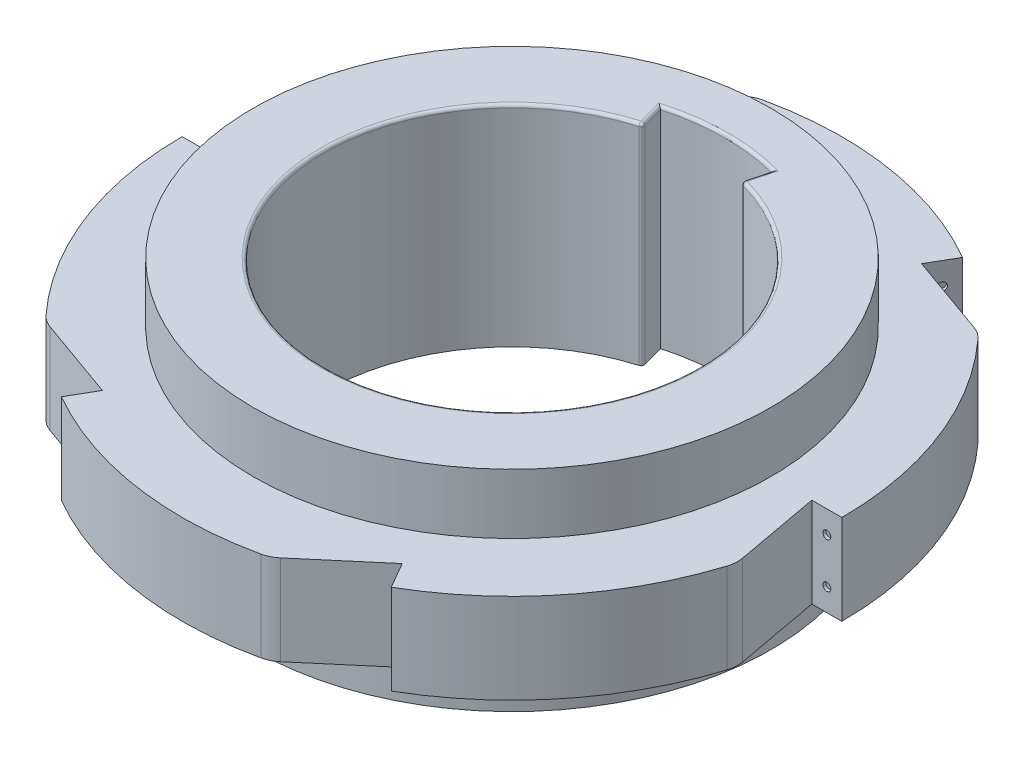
SolidWorks part; units mm, degrees
ref_plane "Front Plane" through (0, 0, 0) normal (0, 0, 1) x (1, 0, 0)
ref_plane "Top Plane" through (0, 0, 0) normal (0, 1, 0) x (1, 0, 0)
ref_plane "Right Plane" through (0, 0, 0) normal (1, 0, 0) x (0, 0, -1)
sketch "Sketch1" plane through (0, 0, 0) normal (0, 1, 0) x (1, 0, 0)
  line L0 (0, 0) -> (100, 0) construction
  line L1 (0, 0) -> (50, -86.6025) construction
  line L2 (50, -86.6025) -> (55, -95.2628)
  line L3 (-50, -86.6025) -> (-55, -95.2628)
  line L4 (100, 0) -> (100, -81.1687) construction
  line L5 (100, 0) -> (105.1902, -28.3244)
  line L6 (100, 0) -> (117.0141, 0) construction
  line L7 (-100, 0) -> (-110, 0)
  line L8 (-50, 86.6025) -> (-55, 95.2628)
  line L9 (50, 86.6025) -> (55, 95.2628)
  line L10 (100, 0) -> (110, 0)
  line L11 (50, -86.6025) -> (28.0654, -105.2596)
  line L12 (-50, -86.6025) -> (-77.1248, -76.9352)
  line L13 (-100, 0) -> (-105.1902, 28.3244)
  line L14 (-50, 86.6025) -> (-28.0654, 105.2596)
  line L15 (50, 86.6025) -> (77.1248, 76.9352)
  arc A2 (23.745, -107.4066) -> (-55, -95.2628) centre (0, 0) cw
  arc A4 (104.8893, -33.1395) -> (55, -95.2628) centre (0, 0) cw
  arc A5 (105.1902, -28.3244) -> (104.8893, -33.1395) centre (95.3539, -30.1268) cw
  arc A6 (-81.1443, -74.2671) -> (-110, 0) centre (0, 0) cw
  arc A7 (-104.8893, 33.1395) -> (-55, 95.2628) centre (0, 0) cw
  arc A8 (-23.745, 107.4066) -> (55, 95.2628) centre (0, 0) cw
  arc A9 (81.1443, 74.2671) -> (110, 0) centre (0, 0) cw
  arc A15 (28.0654, -105.2596) -> (23.745, -107.4066) centre (21.5864, -97.6423) cw
  arc A16 (-77.1248, -76.9352) -> (-81.1443, -74.2671) centre (-73.7676, -67.5155) cw
  arc A17 (-105.1902, 28.3244) -> (-104.8893, 33.1395) centre (-95.3539, 30.1268) cw
  arc A18 (-28.0654, 105.2596) -> (-23.745, 107.4066) centre (-21.5864, 97.6423) cw
  arc A19 (77.1248, 76.9352) -> (81.1443, 74.2671) centre (73.7676, 67.5155) cw
  arc A20 (23.745, -107.4066) -> (-55, -95.2628) centre (0, 0) cw
  arc A21 (-81.1443, -74.2671) -> (-110, 0) centre (0, 0) cw
  arc A22 (-104.8893, 33.1395) -> (-55, 95.2628) centre (0, 0) cw
  arc A23 (-23.745, 107.4066) -> (55, 95.2628) centre (0, 0) cw
  arc A24 (81.1443, 74.2671) -> (110, 0) centre (0, 0) cw
  point P23 (0, 0)
  point P38 (0, 0)
  point P54 (0, 0)
  dimension "D1" = 10
  dimension "D3" = 6
  dimension "D2" = 6
  dimension "D4" = 6
extrude "Boss-Extrude2" add sketch "Sketch1" along normal blind 30
sketch "Sketch2" plane through (0, 30, 0) normal (0, 1, 0) x (1, 0, 0)
  line L2 (-19.1078, 68.7881) -> (-16.7682, 60.3656)
  line L3 (18.0656, 68.7881) -> (15.9142, 60.5964)
  arc A1 (18.0656, 68.7881) -> (-19.035, 68.5261) centre (0, 0) ccw
  arc A2 (-16.7682, 60.3656) -> (15.9142, 60.5964) centre (0, 0) ccw
extrude "Cut-Extrude1" cut sketch "Sketch2" against normal blind 30 contours L2 A2 L3 A1
sketch "Sketch3" plane through (0, 0, 0) normal (0.866, 0, -0.5) x (-0.5, 0, -0.866)
  line L0 (100, 0) -> (110, 0) construction
  line L1 (110, 15) -> (100, 15) construction
  line L2 (110, 30) -> (110, 0) construction
  line L3 (100, 30) -> (100, 0) construction
  circle A1 centre (105, 7.5) radius 1.3214
  circle A2 centre (105, 22.5) radius 1.3214
  dimension "D1" = 7.5
extrude "Cut-Extrude2" cut sketch "Sketch3" against normal blind 1
pattern_circular "CirPattern1" count 6 over 360 about axis through (0, 0, 0) along (0, 1, 0) of "Cut-Extrude2"
sketch "Sketch4" plane through (0, 30, 0) normal (0, 1, 0) x (1, 0, 0)
  line L0 (-19.035, 68.5261) -> (-16.7682, 60.3656) construction
  line L1 (15.9142, 60.5964) -> (18.0656, 68.7881)
  line L2 (-16.7682, 60.3656) -> (-19.035, 68.5261)
  circle A0 centre (0, 0) radius 86.3855
  arc A1 (15.9142, 60.5964) -> (-16.7682, 60.3656) centre (0, 0) cw
  arc A2 (-19.035, 68.5261) -> (18.0656, 68.7881) centre (0, 0) cw
  arc A3 (18.0656, 68.7881) -> (-19.035, 68.5261) centre (0, 0) ccw construction
extrude "Boss-Extrude3" add sketch "Sketch4" along normal blind 20
ref_plane "Plane1" through (0, 15, 0) normal (0, 1, 0) x (1, 0, 0)
mirror "Mirror1" about plane through (0, 15, 0) normal (0, 1, 0) of "Boss-Extrude3"
fillet "Fillet1" radius 1 1 edges at (0.4423, 50, 62.6497)
fillet "Fillet2" radius 1 1 edges at (-0.5021, 50, -71.119)
fillet "Fillet3" radius 1 6 edges at (15.9142, 14.5, -60.5964) (15.9886, 49.7071, -60.8797) (-16.7682, 14.5, -60.3656) (-16.8466, 49.7071, -60.6478) (17.2439, 50, -65.6594) (-18.1693, 50, -65.4094)
